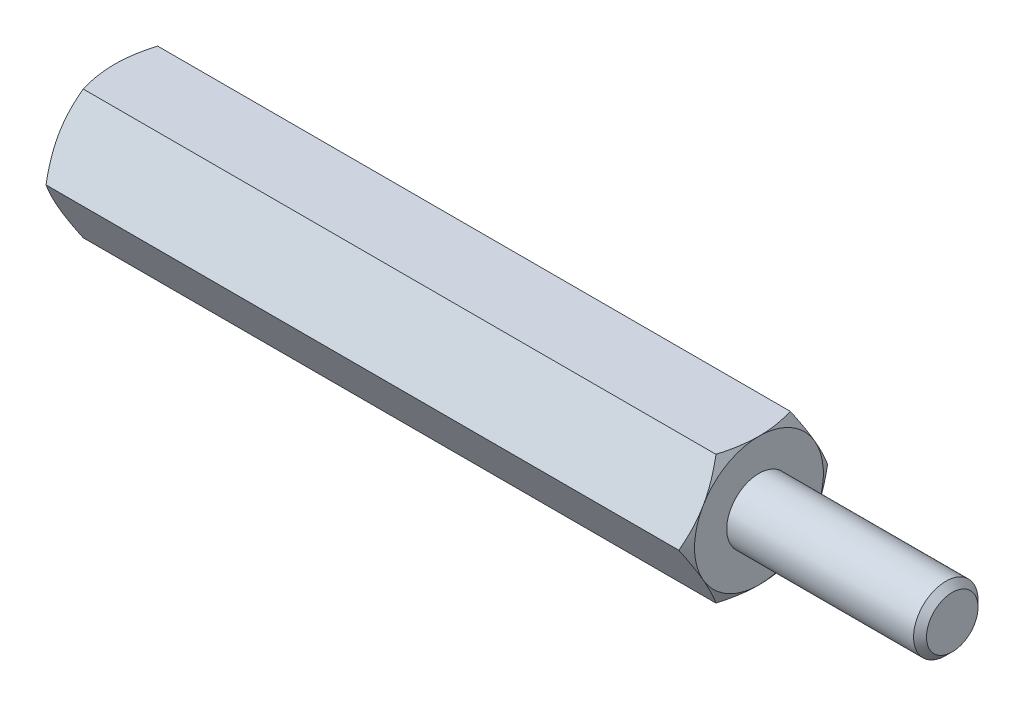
SolidWorks part; units mm, degrees
ref_plane "Front Plane" through (0, 0, 0) normal (0, 0, 1) x (1, 0, 0)
ref_plane "Top Plane" through (0, 0, 0) normal (0, 1, 0) x (1, 0, 0)
ref_plane "Right Plane" through (0, 0, 0) normal (1, 0, 0) x (0, 0, -1)
sketch "Sketch1" plane through (0, 0, 0) normal (1, 0, 0) x (0, 0, -1)
  line L1 (1.1547, 2) -> (-1.1547, 2)
  line L2 (-1.1547, 2) -> (-2.3094, 0)
  line L3 (-2.3094, 0) -> (-1.1547, -2)
  line L4 (-1.1547, -2) -> (1.1547, -2)
  line L5 (1.1547, -2) -> (2.3094, 0)
  line L6 (2.3094, 0) -> (1.1547, 2)
  circle A0 centre (0, 0) radius 2 construction
  dimension "D1" = 4
extrude "Extrude2" add sketch "Sketch1" along normal mid plane 20
sketch "Sketch2" plane through (0, 0, 0) normal (0, 0, 1) x (1, 0, 0)
  line L0 (-10, 2) -> (-8.5, 4.5981)
  line L1 (-10, 5) -> (-10, 2)
  line L3 (0, 0) -> (50000, 0) construction
  arc A0 (-8.5, 4.5981) -> (-10, 5) centre (-9.1962, 5) ccw
  dimension "D1" = 30
  dimension "D2" = 3
revolve "Cut-Revolve1" cut sketch "Sketch2" angle 360 about L3
mirror "Mirror1" about plane through (0, 0, 0) normal (1, 0, 0) of "Cut-Revolve1"
sketch "Sketch3" plane through (-10, 0, 0) normal (-1, 0, 0) x (0, 0, 1)
  circle A0 centre (0, 0) radius 0.8
  dimension "D1" = 1.6
extrude "Extrude3" cut sketch "Sketch3" against normal blind 6
sketch "Sketch4" plane through (0, 0, 0) normal (0, 0, 1) x (1, 0, 0)
  line L0 (-4, 0) -> (-4, 0.8)
  line L1 (9.8214, 0) -> (-9.8214, 0) construction
  line L2 (-4, 0.8) -> (-3.5381, 0)
  line L3 (-3.5381, 0) -> (-4, 0)
  line L4 (-10, 1) -> (-10, -1) construction
  point P4 (-10, 0)
  dimension "D1" = 30
  dimension "D2" = 0.8
  dimension "D3" = 6
revolve "Cut-Revolve2" cut sketch "Sketch4" angle 360 about L3
sketch "Sketch5" plane through (10, 0, 0) normal (1, 0, 0) x (0, 0, -1)
  circle A0 centre (0, 0) radius 1
  dimension "D1" = 2
extrude "Extrude4" add sketch "Sketch5" along normal blind 6
chamfer "Chamfer1" distance 0.2 angle 45 1 edges at (16, 0, -1)
equation "\"D2@Sketch4\" = \"D1@Sketch3\"/2"
